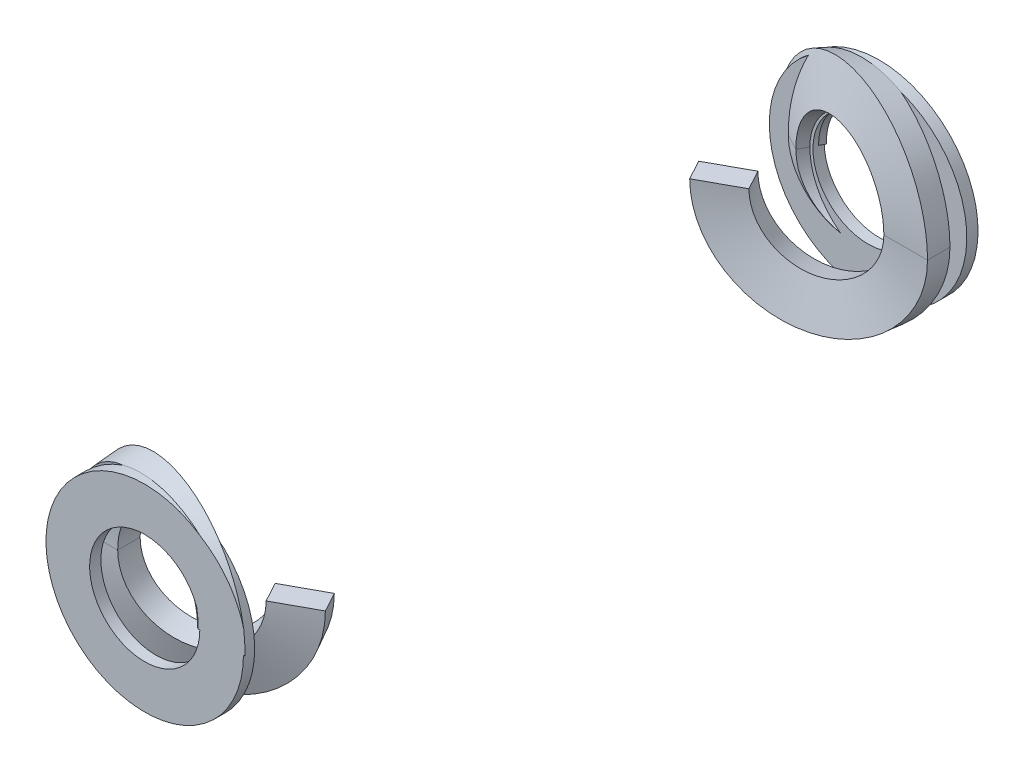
SolidWorks part; units mm, degrees
ref_plane "Front" through (0, 0, 0) normal (0, 0, 1) x (1, 0, 0)
ref_plane "Top" through (0, 0, 0) normal (0, 1, 0) x (1, 0, 0)
ref_plane "Right" through (0, 0, 0) normal (1, 0, 0) x (0, 0, -1)
sketch "Logo3_Revol_Axis" plane through (0, 0, 0) normal (0, 1, 0) x (1, 0, 0)
  line L0 (0, -30.1034) -> (0, 30.1034) construction
sketch "Logo3_bib0" plane through (0, 0, 0) normal (0, 1, 0) x (1, 0, 0)
  line L0 (-9.525, 0) -> (9.525, 0) construction
  line L1 (0, 0) -> (0, 67.31) construction
  dimension "logo3_d1" = 19.05
  dimension "logo3_l1" = 67.31
sketch "logo3_bib1" plane through (0, 0, 0) normal (0, 1, 0) x (1, 0, 0)
  line L0 (-9.525, 0) -> (9.525, 0) construction
  line L1 (9.525, 0) -> (9.525, 67.31) construction
  line L2 (9.525, 67.31) -> (-9.525, 67.31) construction
  line L3 (-9.525, 67.31) -> (-9.525, 0) construction
  line L4 (9.0488, 0) -> (9.0488, 67.31) construction
  line L5 (-9.0488, 68.3387) -> (-9.0487, 0) construction
  line L6 (5.0482, 0) -> (5.0482, 67.31) construction
  line L7 (-5.0482, 0) -> (-5.0482, 68.3387) construction
  line L8 (0, 0) -> (0, 67.31) construction
  line L9 (7.0485, 67.31) -> (7.0485, 0) construction
  line L10 (-7.0485, 67.31) -> (-7.0485, 0) construction
  line L11 (7.0485, 0) -> (-7.0485, 3.6005) construction
  line L12 (0, 1.8002) -> (0.7424, 4.7069) construction
  line L13 (-7.0485, 3.6005) -> (7.0485, 7.2009) construction
  line L14 (-7.0485, 67.31) -> (7.0485, 63.7095) construction
  line L15 (7.0485, 7.2009) -> (-7.0485, 10.8013) construction
  line L16 (0, 5.4007) -> (-0.7424, 8.3074) construction
  line L17 (0, 9.0011) -> (0.7424, 11.9078) construction
  line L18 (0, 65.5098) -> (-0.7424, 62.6031) construction
  line L19 (-22.523, 74.5109) -> (29.4917, 74.5109) construction
  line L20 (-22.523, -14.4018) -> (25.6601, -14.4018) construction
  line L21 (7.0485, 63.7095) -> (-7.0485, 60.1091) construction
  line L22 (0, 61.9093) -> (0.7424, 59.0026) construction
  line L23 (0, 0) -> (-0.7424, 2.9067) construction
  line L24 (-9.0488, 68.3387) -> (-5.0482, 68.3387)
  line L25 (-9.0488, 68.3387) -> (-9.0488, 66.2813)
  line L26 (-9.0488, 66.2813) -> (-5.0482, 66.2813)
  line L27 (-5.0482, 68.3387) -> (-5.0482, 66.2813)
  line L28 (5.0482, -1.0287) -> (9.0488, -1.0287)
  line L29 (5.0482, -1.0287) -> (5.0482, 1.0287)
  line L30 (5.0482, 1.0287) -> (9.0488, 1.0287)
  line L31 (9.0488, -1.0287) -> (9.0488, 1.0287)
  line L32 (0, 67.31) -> (0.7424, 64.4033) construction
  circle A1 centre (7.0485, 63.7095) radius 2.0003
  circle A2 centre (7.0485, 7.2009) radius 2.0002
  circle A4 centre (-7.0485, 3.6005) radius 2.0002
  circle A5 centre (-7.0485, 10.8013) radius 2.0003
  circle A6 centre (-7.0485, 60.1091) radius 2.0002
sketch "Sketch4" plane through (0, 0, 0) normal (0, 1, 0) x (1, 0, 0)
  line L0 (0, 0) -> (0, 67.31) construction
  line L1 (0, 0) -> (0, 67.31) construction
  line L2 (-9.0488, 68.3387) -> (-9.0488, 66.2813) construction
  line L3 (-9.0488, 66.2813) -> (-5.0482, 66.2813) construction
  line L4 (-5.0482, 68.3387) -> (-5.0482, 66.2813) construction
  line L5 (-9.0488, 68.3387) -> (-5.0482, 68.3387) construction
  line L6 (-9.0488, 68.3387) -> (-9.0488, 66.2813)
  line L7 (-9.0488, 66.2813) -> (-5.0482, 66.2813)
  line L8 (-5.0482, 68.3387) -> (-5.0482, 66.2813)
  line L9 (-9.0488, 68.3387) -> (-5.0482, 68.3387)
  line L10 (5.0482, -1.0287) -> (5.0482, 1.0287) construction
  line L11 (5.0482, 1.0287) -> (9.0488, 1.0287) construction
  line L12 (9.0488, -1.0287) -> (9.0488, 1.0287) construction
  line L13 (5.0482, -1.0287) -> (9.0488, -1.0287) construction
  line L14 (5.0482, -1.0287) -> (5.0482, 1.0287)
  line L15 (5.0482, 1.0287) -> (9.0488, 1.0287)
  line L16 (9.0488, -1.0287) -> (9.0488, 1.0287)
  line L17 (5.0482, -1.0287) -> (9.0488, -1.0287)
revolve "Revolve2" add sketch "Sketch4" angle 360 about L1
sketch "Sketch5" plane through (0, 0, 0) normal (0, -1, 0) x (1, 0, 0)
  line L0 (0, -1.8002) -> (0.7424, -4.7069) construction
  line L1 (0, -1.8002) -> (0.7424, -4.7069) construction
  line L2 (-9.0488, -68.3387) -> (-9.0487, 0) construction
  line L3 (-5.0482, 0) -> (-5.0482, -68.3387) construction
  line L7 (-9.0488, -2.5717) -> (-5.0482, -2.5718)
  line L8 (-9.0488, -2.5717) -> (-9.0488, -4.6291)
  line L9 (-9.0488, -4.6291) -> (-5.0482, -4.6292)
  line L10 (-5.0482, -2.5718) -> (-5.0482, -4.6292)
revolve "Revolve3" add sketch "Sketch5" angle 180 about L1
sketch "Sketch6" plane through (0, 0, 0) normal (0, 1, 0) x (1, 0, 0)
  line L0 (0, 5.4007) -> (-0.7424, 8.3074) construction
  line L1 (0, 5.4007) -> (-0.7424, 8.3074) construction
  line L6 (-5.0482, 4.6292) -> (-5.0482, 2.5718) construction
  line L7 (-9.0488, 4.6291) -> (-5.0482, 4.6292) construction
  line L8 (-9.0488, 2.5717) -> (-9.0488, 4.6291) construction
  line L9 (-5.0482, 2.5718) -> (-9.0488, 2.5717) construction
  line L10 (-5.0482, 4.6292) -> (-5.0482, 2.5718)
  line L11 (-9.0488, 4.6291) -> (-5.0482, 4.6292)
  line L12 (-9.0488, 2.5717) -> (-9.0488, 4.6291)
  line L13 (-5.0482, 2.5718) -> (-9.0488, 2.5717)
revolve "Revolve4" add sketch "Sketch6" angle 180 about L1
sketch "Sketch11" plane through (0, 0, 0) normal (0, 1, 0) x (1, 0, 0)
  line L0 (4.7999, 0.0565) -> (8.3105, -1.8619) construction
  line L1 (6.7858, -1.0287) -> (8.3105, -1.8619)
  line L3 (8.3105, -1.8619) -> (9.2971, -0.0565) construction
  line L4 (0, 0) -> (-0.7424, 2.9067) construction
  line L5 (0, 0) -> (-0.7424, 2.9067) construction
  line L7 (8.3105, -1.8619) -> (8.7658, -1.0287)
  line L8 (5.0482, -1.0287) -> (9.0488, -1.0287) construction
  line L10 (6.7858, -1.0287) -> (8.7658, -1.0287)
revolve "Revolve8" add sketch "Sketch11" angle 90 about L5
sketch "Sketch8" plane through (0, 0, 0) normal (0, 1, 0) x (1, 0, 0)
  line L0 (0, 65.5098) -> (-0.7424, 62.6031) construction
  line L1 (0, 65.5098) -> (-0.7424, 62.6031) construction
  line L2 (9.0488, 0) -> (9.0488, 67.31) construction
  line L3 (5.0482, 0) -> (5.0482, 67.31) construction
  line L11 (9.0487, 64.7382) -> (5.0482, 64.7382)
  line L12 (9.0487, 64.7382) -> (9.0487, 62.6808)
  line L13 (9.0487, 62.6808) -> (5.0482, 62.6808)
  line L14 (5.0482, 64.7382) -> (5.0482, 62.6808)
revolve "Revolve6" add sketch "Sketch8" angle 180 about L1
sketch "Sketch10" plane through (0, 0, 0) normal (0, 1, 0) x (1, 0, 0)
  line L0 (0, 61.9093) -> (0.7424, 59.0026) construction
  line L1 (0, 61.9093) -> (0.7424, 59.0026) construction
  line L11 (9.0487, 62.6808) -> (9.0487, 64.7382)
  line L12 (5.0482, 62.6808) -> (9.0487, 62.6808)
  line L13 (5.0482, 64.7382) -> (5.0482, 62.6808)
  line L14 (9.0487, 64.7382) -> (5.0482, 64.7382)
  line L15 (9.0487, 62.6808) -> (9.0487, 64.7382)
  line L16 (5.0482, 62.6808) -> (9.0487, 62.6808)
  line L17 (5.0482, 64.7382) -> (5.0482, 62.6808)
  line L18 (9.0487, 64.7382) -> (5.0482, 64.7382)
  dimension "D1" = 0
revolve "Revolve7" add sketch "Sketch10" angle 180 about L1
sketch "Sketch13" plane through (0, 0, 0) normal (0, 1, 0) x (1, 0, 0)
  line L0 (-4.7999, 67.2535) -> (-5.7865, 65.4481) construction
  line L1 (-5.7865, 65.4481) -> (-9.2971, 67.3665) construction
  line L2 (-5.3312, 66.2813) -> (-5.7865, 65.4481)
  line L3 (-5.7865, 65.4481) -> (-7.3112, 66.2813)
  line L4 (-9.0488, 66.2813) -> (-5.0482, 66.2813) construction
  line L5 (-7.3112, 66.2813) -> (-5.3312, 66.2813)
  line L6 (0, 67.31) -> (0.7424, 64.4033) construction
  line L7 (0, 67.31) -> (0.7424, 64.4033) construction
revolve "Revolve9" add sketch "Sketch13" angle 90 about L7
sketch "Sketch9" plane through (0, 0, 0) normal (0, 1, 0) x (1, 0, 0)
  line L0 (9.525, 0) -> (9.525, 67.31) construction
  line L1 (-9.525, 0) -> (9.525, 0)
  line L2 (-9.525, 0) -> (-9.525, -14.4018)
  line L3 (-9.525, -14.4018) -> (9.525, -14.4018)
  line L4 (9.525, 0) -> (9.525, -14.4018)
  line L5 (-9.525, 67.31) -> (-9.525, 0) construction
  line L6 (9.525, 67.31) -> (-9.525, 67.31)
  line L7 (9.525, 67.31) -> (9.525, 74.5109)
  line L8 (9.525, 74.5109) -> (-9.525, 74.5109)
  line L9 (-9.525, 67.31) -> (-9.525, 74.5109)
  line L10 (-22.523, -14.4018) -> (25.6601, -14.4018) construction
  line L11 (-22.523, 74.5109) -> (29.4917, 74.5109) construction
extrude "Cut-Extrude1" cut sketch "Sketch9" against normal through all and the other way through all
sketch "Sketch14" plane through (0, 0, 0) normal (0, 1, 0) x (1, 0, 0)
  line L0 (7.0485, 67.31) -> (7.0485, 0) construction
  line L1 (-7.0485, 67.31) -> (-7.0485, 0) construction
  line L2 (7.0485, 67.31) -> (7.0485, 0) construction
  line L3 (-7.0485, 67.31) -> (-7.0485, 0) construction
equation "\"Ray1@logo3_bib1\" = \"Logo3_d2*1.06/2@logo3_bib1\""
equation "\"Ray2@logo3_bib1\" = \"Logo3_(d1-(.1*d2))/2@logo3_bib1\""
equation "\"Ray3@logo3_bib1\" = (\"Ray1@logo3_bib1\"+\"Ray2@logo3_bib1\")/2"
equation "\"Ray3bis@logo3_bib1\" = \"Ray3@logo3_bib1\""
equation "\"Dist1@logo3_bib1\" = (\"Logo3_(d1-(.1*d2))/2@logo3_bib1\"-\"Logo3_d2*1.06/2@logo3_bib1\")*.9"
equation "\"Dist2@logo3_bib1\" = \"Dist1@logo3_bib1\"*2"
equation "\"Dist3@logo3_bib1\" = \"Dist1@logo3_bib1\"*3"
equation "\"Dist1bis@logo3_bib1\" = \"Dist1@logo3_bib1\""
equation "\"Dist4@logo3_bib1\" = \"Dist1@logo3_bib1\"*2"
equation "\"Dist5@logo3_bib1\" = \"Dist4@logo3_bib1\"*2"
equation "\"Dist2bis@logo3_bib1\" = \"Dist2@logo3_bib1\""
equation "\"EpBrin@logo3_bib1\" = \"Dist1bis@logo3_bib1\"/3.5"
equation "\"EpBrin_1@logo3_bib1\" = \"EpBrin@logo3_bib1\""
equation "\"EpBrin_2@logo3_bib1\" = \"EpBrin@logo3_bib1\""
equation "\"EpBrin_3@logo3_bib1\" = \"EpBrin@logo3_bib1\""
equation "\"EpBrin_1@Sketch5\" = \"EpBrin@logo3_bib1\""
equation "\"EpBrin_2@Sketch5\" = \"EpBrin@logo3_bib1\""
equation "\"EpBrin_1@Sketch8\" = \"EpBrin@logo3_bib1\""
equation "\"EpBrin_2@Sketch8\" = \"EpBrin@logo3_bib1\""
